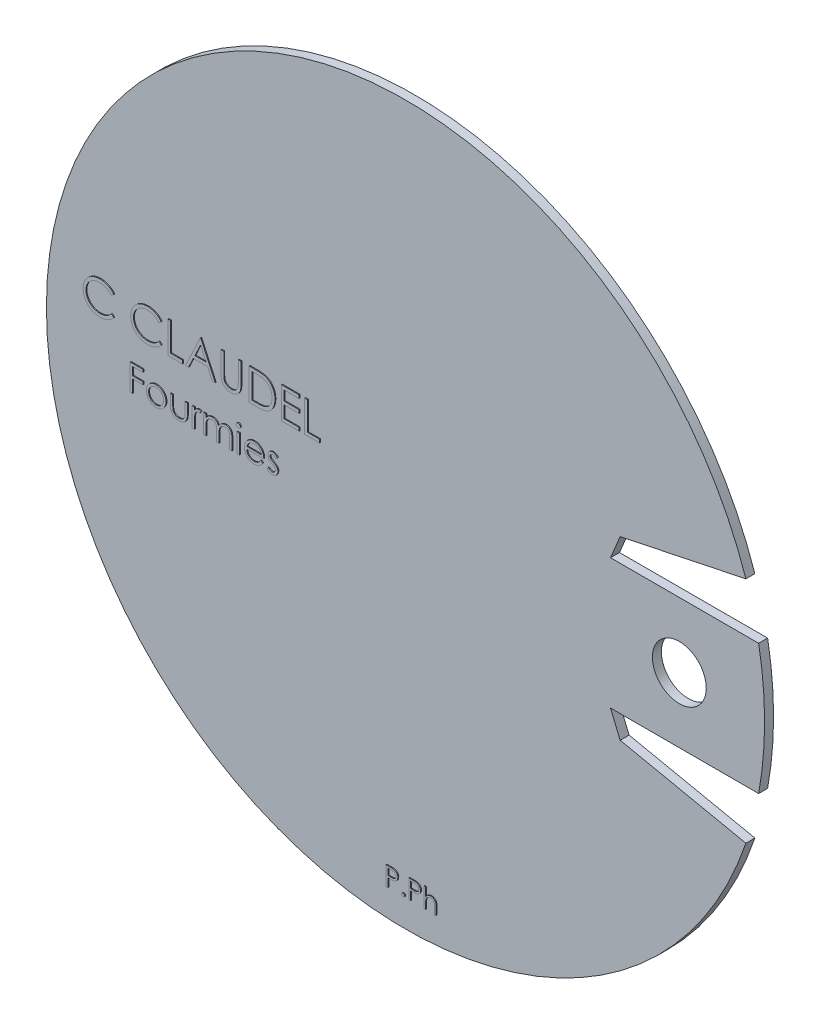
SolidWorks part; units mm, degrees
ref_plane "Plan de face" through (0, 0, 0) normal (0, 0, 1) x (1, 0, 0)
ref_plane "Plan de dessus" through (0, 0, 0) normal (0, 1, 0) x (1, 0, 0)
ref_plane "Plan de droite" through (0, 0, 0) normal (1, 0, 0) x (0, 0, -1)
sketch "Esquisse1" plane through (0, 0, 0) normal (0, 0, 1) x (1, 0, 0)
  circle A0 centre (0, 0) radius 40
  dimension "D1" = 80
extrude "Boss.-Extru.1" add sketch "Esquisse1" along normal blind 1
sketch "Esquisse2" plane through (0, 0, 1) normal (0, 0, 1) x (1, 0, 0)
  line L0 (0, 0) -> (46.22, 0) construction
  circle A0 centre (30.5, 0) radius 3
  circle A1 centre (0, 0) radius 40 construction
  dimension "D1" = 6
  dimension "D2" = 30.5
extrude "Enlèv. mat.-Extru.1" cut sketch "Esquisse2" against normal through all
sketch "Esquisse3" plane through (0, 0, 1) normal (0, 0, 1) x (1, 0, 0)
  line L0 (0, 0) -> (40, 0) construction
  line L1 (22.8375, 7.25) -> (39.3375, 7.25)
  line L2 (22.8375, 7.25) -> (23.9085, 9.8241)
  line L3 (23.9085, 9.8241) -> (37.9136, 12.75)
  line L4 (22.8375, -7.25) -> (39.3375, -7.25)
  line L5 (22.8375, -7.25) -> (23.9085, -9.8241)
  line L6 (23.9085, -9.8241) -> (37.9136, -12.75)
  circle A0 centre (0, 0) radius 40 construction
  arc A2 (37.9136, -12.75) -> (39.3375, -7.25) centre (0, 0) ccw
  circle A3 centre (0, 0) radius 40
  arc A4 (39.3375, 7.25) -> (37.9136, 12.75) centre (0, 0) ccw
  dimension "D1" = 7.25
  dimension "D2" = 16.5
  dimension "D3" = 5.5
  dimension "D4" = 0
extrude "Enlèv. mat.-Extru.2" cut sketch "Esquisse3" against normal through all
sketch "Esquisse4" plane through (0, 0, 1) normal (0, 0, 1) x (1, 0, 0)
  text T0 "C CLAUDEL"
  text T1 "Fourmies" font "Century Gothic" height in points 11
  text T2 "P.Ph" font "Century Gothic" height in points 8
extrude "Boss.-Extru.2" add sketch "Esquisse4" along normal blind 0.1
